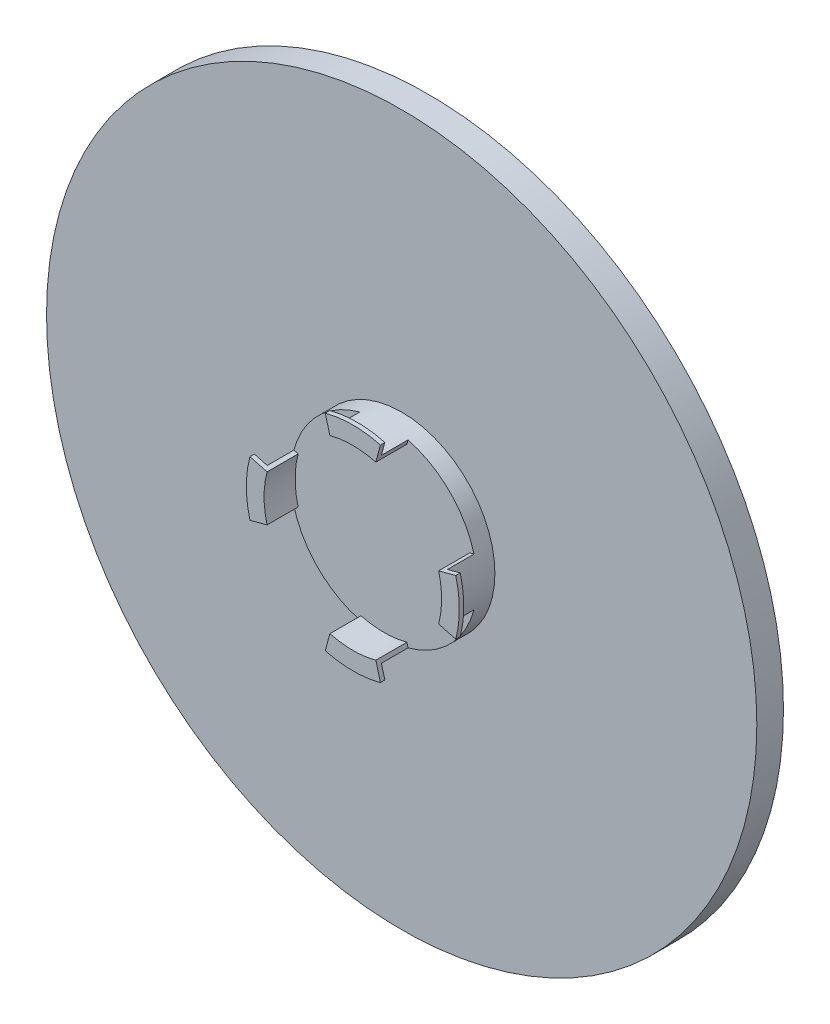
SolidWorks part; units mm, degrees
ref_plane "Plan de face" through (0, 0, 0) normal (0, 0, 1) x (1, 0, 0)
ref_plane "Plan de dessus" through (0, 0, 0) normal (0, 1, 0) x (1, 0, 0)
ref_plane "Plan de droite" through (0, 0, 0) normal (1, 0, 0) x (0, 0, -1)
sketch "Esquisse1" plane through (0, 0, 0) normal (0, 0, 1) x (1, 0, 0)
  line L0 (0, 400) -> (0, 0) construction
  line L1 (0, -55) -> (0, 55) construction
  line L2 (0, 0) -> (346.4102, -200) construction
  line L3 (0, 0) -> (-346.4102, -200) construction
  circle A0 centre (0, 0) radius 400
  dimension "D1" = 800
extrude "Extrusion1" add sketch "Esquisse1" along normal blind 30
sketch "Esquisse3" plane through (0, 0, 30) normal (0, 0, 1) x (1, 0, 0)
  circle A0 centre (0, 0) radius 105
  dimension "D1" = 210
extrude "Extrusion2" add sketch "Esquisse3" along normal blind 20
sketch "Esquisse4" plane through (0, 0, 50) normal (0, 0, 1) x (1, 0, 0)
  line L0 (0, -105) -> (0, 105) construction
  line L1 (-105, 0) -> (105, 0) construction
  line L2 (-25.8819, 96.5926) -> (-27.176, 101.4222)
  line L3 (25.8819, 96.5926) -> (27.176, 101.4222)
  line L4 (96.5926, 25.8819) -> (101.4222, 27.176)
  line L5 (96.5926, -25.8819) -> (101.4222, -27.176)
  line L6 (-25.8819, -96.5926) -> (-27.176, -101.4222)
  line L7 (25.8819, -96.5926) -> (27.176, -101.4222)
  line L8 (-96.5926, 25.8819) -> (-101.4222, 27.176)
  line L9 (-96.5926, -25.8819) -> (-101.4222, -27.176)
  arc A0 (27.176, 101.4222) -> (-27.176, 101.4222) centre (0, 0) ccw
  arc A3 (96.5926, -25.8819) -> (96.5926, 25.8819) centre (0, 0) ccw
  arc A4 (101.4222, -27.176) -> (101.4222, 27.176) centre (0, 0) ccw
  arc A5 (25.8819, 96.5926) -> (-25.8819, 96.5926) centre (0, 0) ccw
  arc A7 (-101.4222, 27.176) -> (-101.4222, -27.176) centre (0, 0) ccw
  arc A8 (-96.5926, 25.8819) -> (-96.5926, -25.8819) centre (0, 0) ccw
  arc A10 (-25.8819, -96.5926) -> (25.8819, -96.5926) centre (0, 0) ccw
  arc A11 (-27.176, -101.4222) -> (27.176, -101.4222) centre (0, 0) ccw
  dimension "D1" = 210
  dimension "D2" = 15
  dimension "D3" = 15
  dimension "D4" = 15
  dimension "D5" = 15
  dimension "D6" = 15
  dimension "D7" = 15
  dimension "D8" = 15
extrude "Extrusion3" add sketch "Esquisse4" along normal blind 30
sketch "Esquisse6" plane through (0, 0, 80) normal (0, 0, 1) x (1, 0, 0)
  line L0 (-25.8819, 96.5926) -> (-31.0583, 115.9111)
  line L1 (25.8819, 96.5926) -> (31.0583, 115.9111)
  line L2 (96.5926, 25.8819) -> (115.9111, 31.0583)
  line L3 (96.5926, -25.8819) -> (115.9111, -31.0583)
  line L4 (-96.5926, 25.8819) -> (-115.9111, 31.0583)
  line L5 (-96.5926, -25.8819) -> (-115.9111, -31.0583)
  line L6 (-25.8819, -96.5926) -> (-31.0583, -115.9111)
  line L7 (25.8819, -96.5926) -> (31.0583, -115.9111)
  arc A0 (-25.8819, -96.5926) -> (25.8819, -96.5926) centre (0, 0) ccw
  arc A1 (-31.0583, -115.9111) -> (31.0583, -115.9111) centre (0, 0) ccw
  arc A2 (96.5926, -25.8819) -> (96.5926, 25.8819) centre (0, 0) ccw
  arc A3 (115.9111, -31.0583) -> (115.9111, 31.0583) centre (0, 0) ccw
  arc A4 (-96.5926, 25.8819) -> (-96.5926, -25.8819) centre (0, 0) ccw
  arc A5 (-115.9111, 31.0583) -> (-115.9111, -31.0583) centre (0, 0) ccw
  arc A6 (25.8819, 96.5926) -> (-25.8819, 96.5926) centre (0, 0) ccw
  arc A7 (31.0583, 115.9111) -> (-31.0583, 115.9111) centre (0, 0) ccw
  dimension "D1" = 240
extrude "Extrusion5" add sketch "Esquisse6" along normal blind 5
